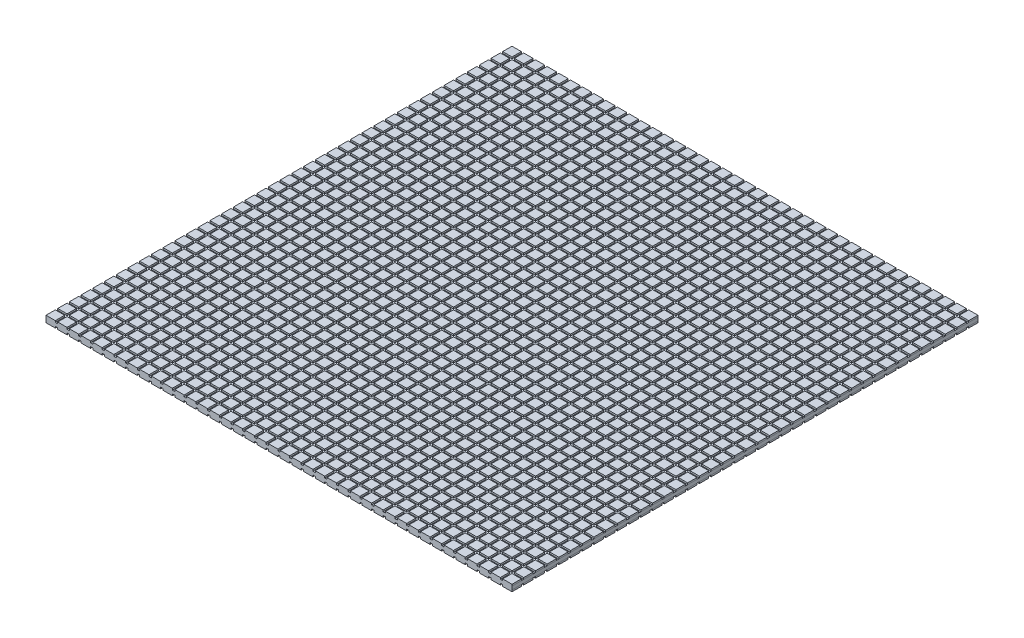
SolidWorks part; units mm, degrees
ref_plane "Front Plane" through (0, 0, 0) normal (0, 0, 1) x (1, 0, 0)
ref_plane "Top Plane" through (0, 0, 0) normal (0, 1, 0) x (1, 0, 0)
ref_plane "Right Plane" through (0, 0, 0) normal (1, 0, 0) x (0, 0, -1)
sketch "Sketch1" plane through (0, 0, 0) normal (0, 1, 0) x (1, 0, 0)
  line L1 (250, -250) -> (-250, -250)
  line L2 (250, -250) -> (250, 250)
  line L3 (250, 250) -> (-250, 250)
  line L4 (-250, -250) -> (-250, 250)
  line L5 (250, -250) -> (-250, 250) construction
  line L6 (250, 250) -> (-250, -250) construction
  point P0 (0, 0)
  dimension "D1" = 500
extrude "Boss-Extrude1" add sketch "Sketch1" along normal mid plane 3.5
sketch "Sketch2" plane through (0, 0, 0) normal (0, 1, 0) x (1, 0, 0)
  line L0 (-250, 250) -> (-250, -250) construction
  line L1 (-250, -250) -> (-240, -250)
  line L2 (-250, -250) -> (-250, -240)
  line L3 (-250, -240) -> (-240, -240)
  line L4 (-240, -250) -> (-240, -240)
  line L5 (-250, -250) -> (-240, -240) construction
  line L6 (-250, -240) -> (-240, -250) construction
  line L7 (-250, -250) -> (250, -250) construction
  point P0 (-245, -245)
  dimension "D1" = 10
extrude "Boss-Extrude2" add sketch "Sketch2" along normal mid plane 7
pattern_linear "LPattern4" count 40 spacing 12.5641 along (0, 0, -1) of "Boss-Extrude2"
pattern_linear "LPattern5" count 40 spacing 12.5641 along (1, 0, 0) of "LPattern4", "Boss-Extrude2"
